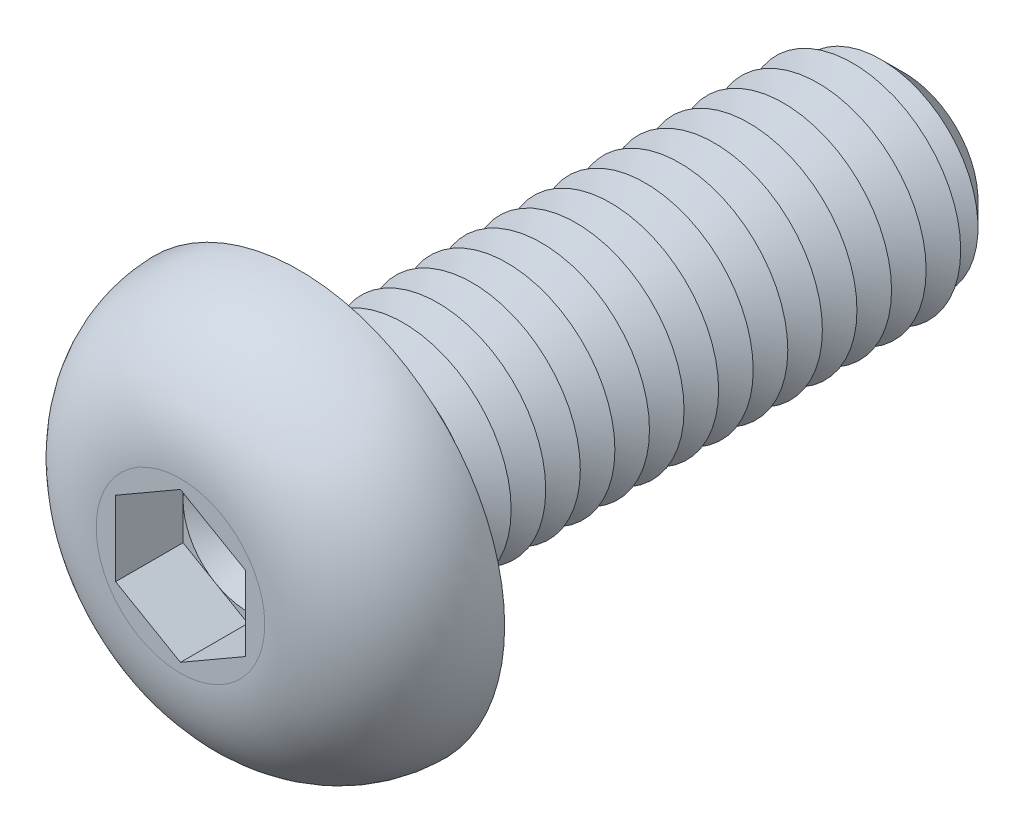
SolidWorks part; units mm, degrees
ref_plane "Front Plane" through (0, 0, 0) normal (0, 0, 1) x (1, 0, 0)
ref_plane "Top Plane" through (0, 0, 0) normal (0, 1, 0) x (1, 0, 0)
ref_plane "Right Plane" through (0, 0, 0) normal (1, 0, 0) x (0, 0, -1)
sketch "Sketch1" plane through (0, 0, 0) normal (1, 0, 0) x (0, 0, -1)
  line L0 (-47.9342, 0) -> (60.3146, 0) construction
sketch "Sketch2" plane through (0, 0, 0) normal (1, 0, 0) x (0, 0, -1)
  line L0 (0, 0) -> (-2.75, 0)
  line L1 (-47.9342, 0) -> (60.3146, 0) construction
  line L2 (-2.75, 0) -> (-2.75, 1.9504)
  line L3 (0, 4.75) -> (0, 0)
  arc A0 (-2.75, 1.9504) -> (0, 4.75) centre (0.05, 1.9504) cw
  dimension "D1" = 2.8
  dimension "D2" = 2.75
  dimension "D3" = 4.75
revolve "Revolve1" add sketch "Sketch2" angle 360 about L0
sketch "Sketch3" plane through (0, 0, 2.75) normal (0, 0, 1) x (1, 0, 0)
  line L1 (0, 1.7321) -> (-1.5, 0.866)
  line L2 (-1.5, 0.866) -> (-1.5, -0.866)
  line L3 (-1.5, -0.866) -> (0, -1.7321)
  line L4 (0, -1.7321) -> (1.5, -0.866)
  line L5 (1.5, -0.866) -> (1.5, 0.866)
  line L6 (1.5, 0.866) -> (0, 1.7321)
  circle A0 centre (0, 0) radius 1.5 construction
  dimension "D1" = 3
extrude "Cut-Extrude1" cut sketch "Sketch3" against normal blind 1.56
sketch "Sketch4" plane through (0, 0, 0) normal (0, 0, -1) x (-1, 0, 0)
  circle A0 centre (0, 0) radius 2.5
  dimension "D1" = 5
extrude "Boss-Extrude1" add sketch "Sketch4" along normal blind 14
chamfer "Chamfer1" distance 0.8 angle 45 1 edges at (-2.5, 0, -14)
sketch "Sketch5" plane through (0, 0, 0) normal (1, 0, 0) x (0, 0, -1)
  line L0 (0.8, 2.5) -> (1.6, 2.5)
  line L1 (13.2, 2.5) -> (0, 2.5) construction
  line L2 (1.6, 2.5) -> (1.2, 1.8072)
  line L3 (1.2, 1.8072) -> (0.8, 2.5)
  line L4 (0, -4.75) -> (0, 4.75) construction
  line L5 (13.2, 2.5) -> (0, 2.5) construction
  dimension "D1" = 0.8
  dimension "D2" = 0.8
revolve "Cut-Revolve1" cut sketch "Sketch5" angle 360 about L0
pattern_linear "LPattern1" count 16 spacing 0.8 along (0, 0, -1) of "Cut-Revolve1"
fillet "Fillet2" radius 0.4 1 edges at (2.5, 0, 0)
sketch "Sketch6" plane through (0, 0, 1.19) normal (0, 0, 1) x (1, 0, 0)
  line L0 (0, -1.7321) -> (1.5, -0.866) construction
  circle A0 centre (0, 0) radius 1.5
extrude "Cut-Extrude2" cut sketch "Sketch6" against normal through all draft 60
